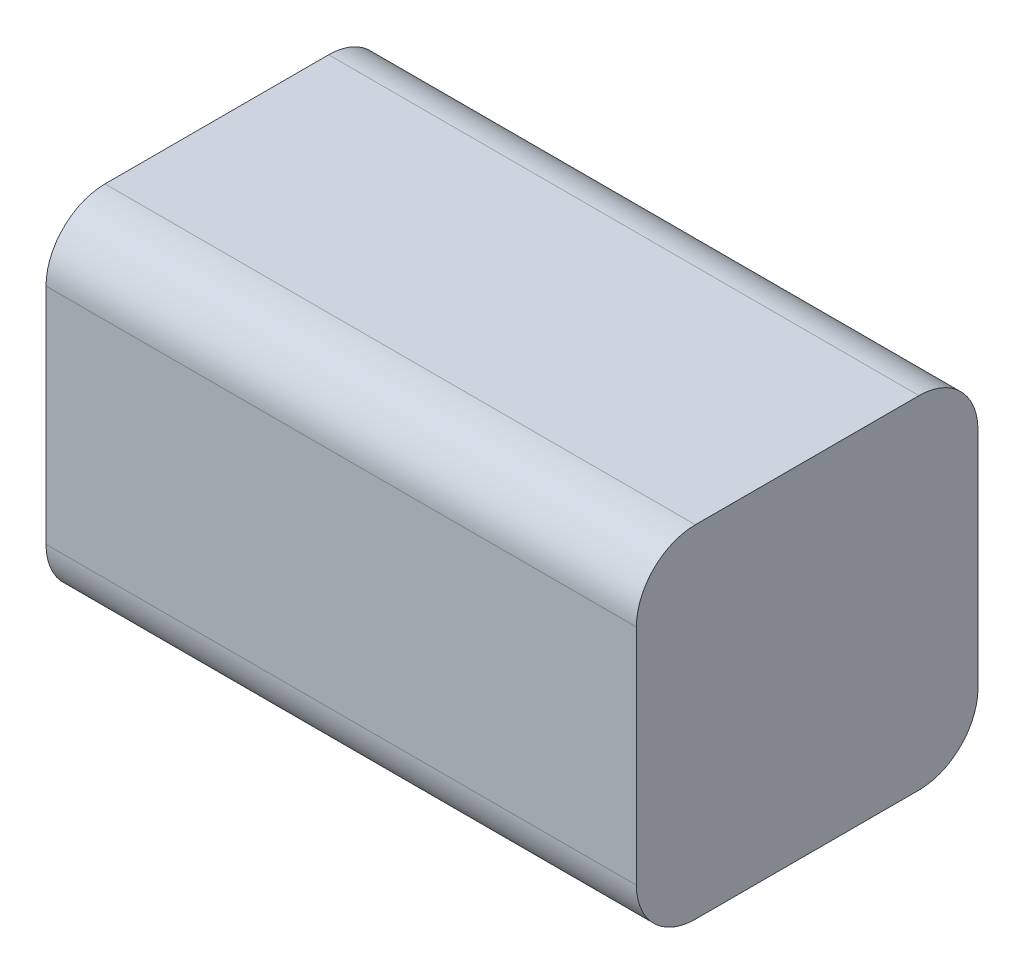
SolidWorks part; units mm, degrees
ref_plane "Front Plane" through (0, 0, 0) normal (0, 0, 1) x (1, 0, 0)
ref_plane "Top Plane" through (0, 0, 0) normal (0, 1, 0) x (1, 0, 0)
ref_plane "Right Plane" through (0, 0, 0) normal (1, 0, 0) x (0, 0, -1)
sketch "Sketch1" plane through (0, 0, 0) normal (0, 1, 0) x (1, 0, 0)
  line L1 (0, 0) -> (-50.038, 0)
  line L2 (0, 0) -> (0, -28.956)
  line L3 (0, -28.956) -> (-50.038, -28.956)
  line L4 (-50.038, 0) -> (-50.038, -28.956)
  dimension "D1" = 50.038
  dimension "D2" = 28.956
extrude "Boss-Extrude1" add sketch "Sketch1" along normal blind 28.956
fillet "Fillet1" radius 5 4 edges at (-25.019, 28.956, 28.956) (-25.019, 0, 28.956) (-25.019, 0, 0) (-25.019, 28.956, 0)
